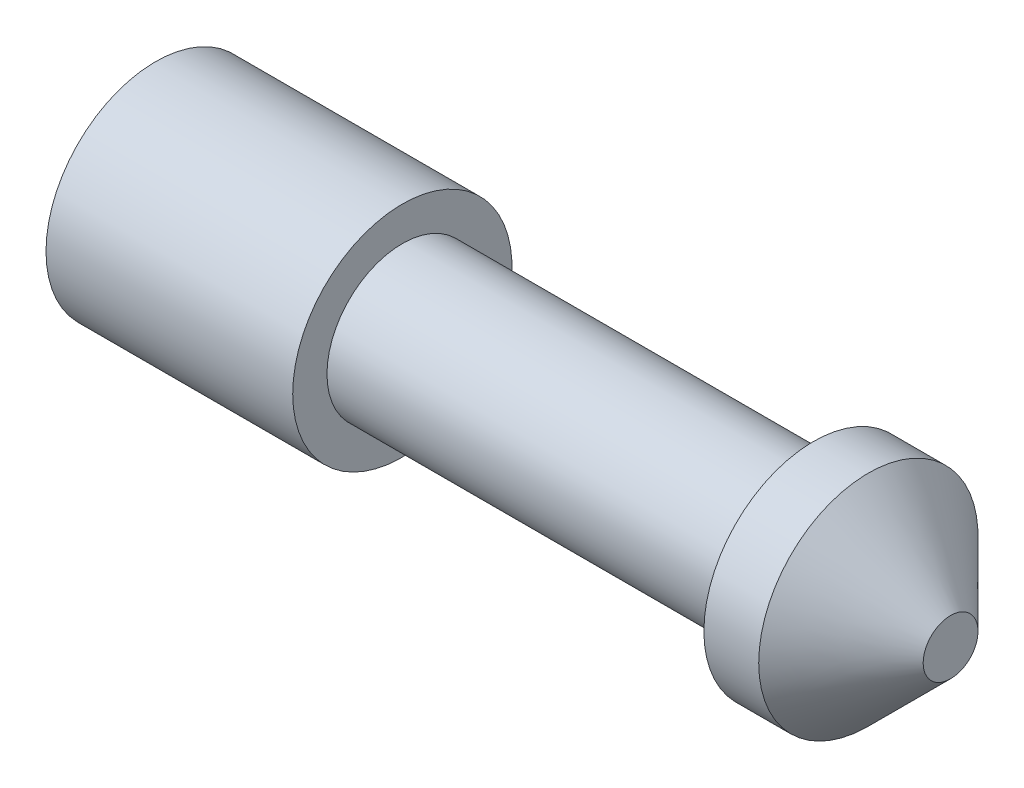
SolidWorks part; units mm, degrees
ref_plane "Front" through (0, 0, 0) normal (0, 0, 1) x (1, 0, 0)
ref_plane "Top" through (0, 0, 0) normal (0, 1, 0) x (1, 0, 0)
ref_plane "Right" through (0, 0, 0) normal (1, 0, 0) x (0, 0, -1)
sketch "Sketch1" plane through (0, 0, 0) normal (0, 1, 0) x (1, 0, 0)
  line L0 (0, 4) -> (0, 0)
  line L1 (0, 0) -> (29, 0)
  line L2 (9, 4) -> (9, 2.75)
  line L3 (24, 4) -> (24, 2.75)
  line L5 (9, 2.75) -> (24, 2.75)
  line L6 (0, 4) -> (9, 4)
  line L7 (24, 4) -> (26, 4)
  line L8 (0, 2.75) -> (29, 2.75) construction
  line L10 (9, 4) -> (9, 0) construction
  line L11 (24, 4) -> (24, 0) construction
  line L13 (26, 4) -> (29, 1)
  line L14 (29, 0) -> (29, 1)
  dimension "D1" = 9
  dimension "D2" = 15
  dimension "D3" = 2
  dimension "D4" = 3
  dimension "D5" = 45
  dimension "D6" = 4
  dimension "D7" = 2.75
revolve "Revolve1" add sketch "Sketch1" angle 360 about L1
